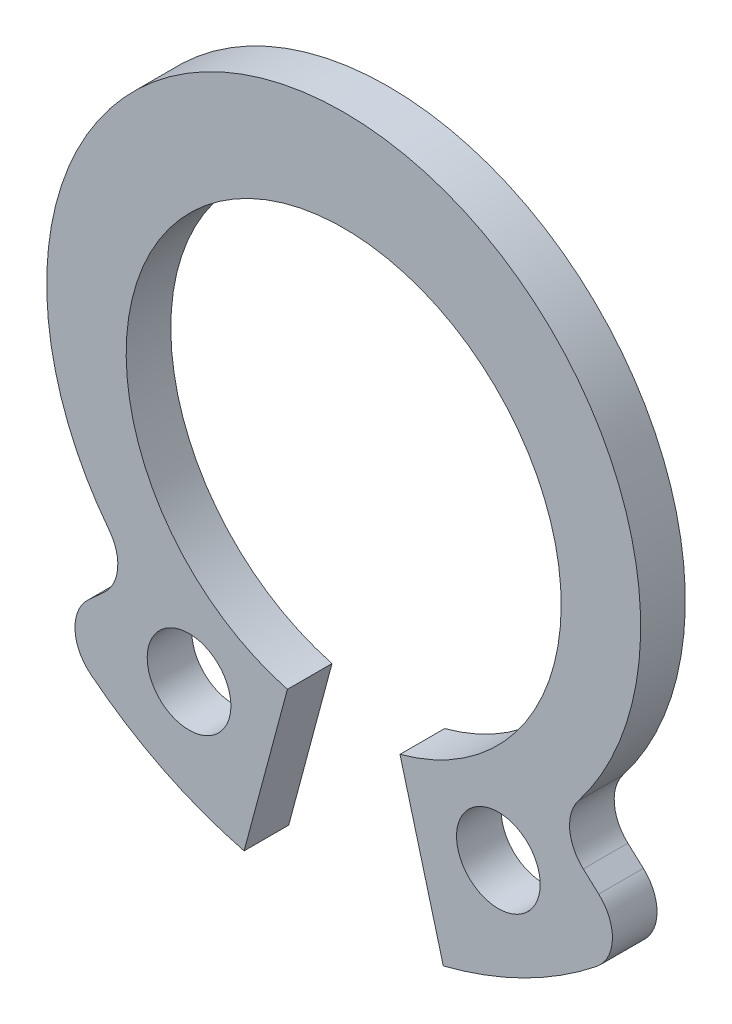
SolidWorks part; units mm, degrees
ref_plane "Plan1" through (0, 0, 0) normal (0, 0, 1) x (1, 0, 0)
ref_plane "Plan2" through (0, 0, 0) normal (0, 1, 0) x (1, 0, 0)
ref_plane "Plan3" through (0, 0, 0) normal (1, 0, 0) x (0, 0, -1)
sketch "Esquisse1" plane through (0, 0, 0) normal (0, 0, 1) x (1, 0, 0)
  line L0 (0, 0) -> (1.7859, -6.6649) construction
  line L1 (0, 0) -> (0, -67.082) construction
  line L2 (4.2955, -3.9038) -> (4.5728, -4.1558)
  line L3 (1.0094, -3.7671) -> (1.7859, -6.6649)
  line L4 (-1.0094, -3.7671) -> (-1.7859, -6.6649)
  line L5 (-4.2955, -3.9038) -> (-4.5728, -4.1558)
  line L6 (1.0094, -3.7671) -> (4.5369, -5.2965) construction
  line L7 (0, 0) -> (0, 3.9) construction
  line L8 (0, 3.9) -> (0, 5.7) construction
  arc A0 (1.0094, -3.7671) -> (-1.0094, -3.7671) centre (0, 0) ccw
  arc A1 (1.7859, -6.6649) -> (4.5369, -5.2965) centre (0, 0.375) ccw
  arc A2 (4.2073, -2.889) -> (-4.2073, -2.889) centre (0, 0.375) ccw
  arc A3 (-4.5369, -5.2965) -> (-1.7859, -6.6649) centre (0, 0.375) ccw
  arc A4 (-4.2073, -2.889) -> (-4.2955, -3.9038) centre (-4.7999, -3.3488) cw
  arc A5 (4.2073, -2.889) -> (4.2955, -3.9038) centre (4.7999, -3.3488) ccw
  circle A6 centre (2.7731, -4.5318) radius 0.75
  circle A7 centre (-2.7731, -4.5318) radius 0.75
  arc A8 (-4.5369, -5.2965) -> (-4.5728, -4.1558) centre (-4.0684, -4.7108) cw
  arc A9 (4.5369, -5.2965) -> (4.5728, -4.1558) centre (4.0684, -4.7108) ccw
  point P22 (-5.1843, -4.7115)
  dimension "D1" = 7.8
  dimension "D2" = 3
  dimension "D3" = 1.8
  dimension "R" = 0.75
  dimension "D8" = 1.5
  dimension "D4" = 0.375
  dimension "D5" = 3.75
  dimension "a" = 15
extrude "Base-Extrusion" add sketch "Esquisse1" along normal blind 0.8
equation "\"R@Esquisse1\" = \"D8@Esquisse1\"/2"
equation "\"D4@Esquisse1\"=\"R@Esquisse1\"/2"
equation "\"D5@Esquisse1\"=\"D8@Esquisse1\"*2.5"
